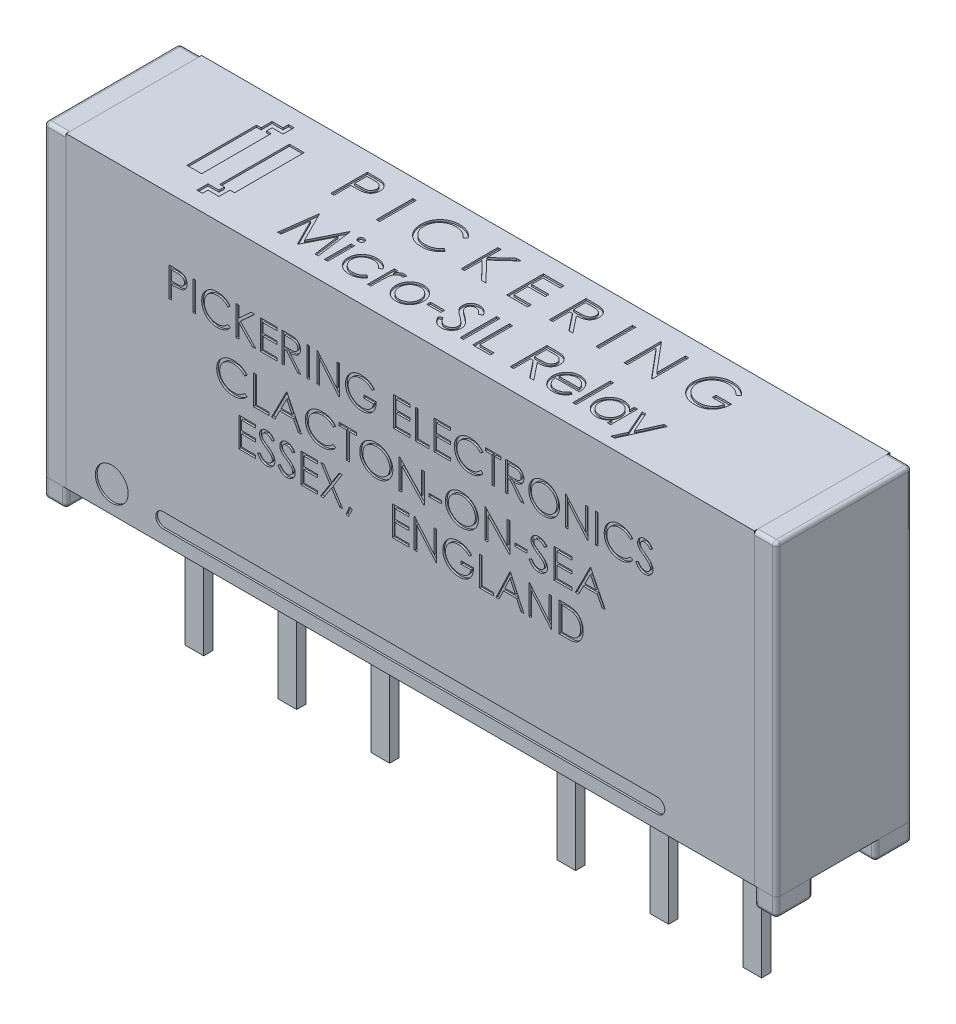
SolidWorks part; units mm, degrees
ref_plane "Front Plane" through (0, 0, 0) normal (0, 0, 1) x (1, 0, 0)
ref_plane "Top Plane" through (0, 0, 0) normal (0, 1, 0) x (1, 0, 0)
ref_plane "Right Plane" through (0, 0, 0) normal (1, 0, 0) x (0, 0, -1)
sketch "Sketch1" plane through (0, 0, 0) normal (0, 1, 0) x (1, 0, 0)
  line L1 (9.4, -1.85) -> (-9.4, -1.85)
  line L2 (9.4, -1.85) -> (9.4, 1.85)
  line L3 (9.4, 1.85) -> (-9.4, 1.85)
  line L4 (-9.4, -1.85) -> (-9.4, 1.85)
  line L5 (9.4, -1.85) -> (-9.4, 1.85) construction
  line L6 (9.4, 1.85) -> (-9.4, -1.85) construction
  point P0 (0, 0)
  dimension "D1" = 3.7
  dimension "D2" = 18.8
extrude "Main Body" add sketch "Sketch1" along normal blind 8.392
sketch "Sketch2" plane through (-9.4, 0, 0) normal (-1, 0, 0) x (0, 0, 1)
  line L1 (-1.85, 8.392) -> (1.85, 8.392)
  line L2 (-1.85, 8.392) -> (-1.85, 0)
  line L3 (-1.85, 0) -> (1.85, 0)
  line L4 (1.85, 8.392) -> (1.85, 0)
extrude "Left Side" add sketch "Sketch2" along normal blind 0.6 separate body
sketch "Sketch3" plane through (9.4, 0, 0) normal (1, 0, 0) x (0, 0, -1)
  line L1 (-1.85, 8.392) -> (1.85, 8.392)
  line L2 (-1.85, 8.392) -> (-1.85, 0)
  line L3 (-1.85, 0) -> (1.85, 0)
  line L4 (1.85, 8.392) -> (1.85, 0)
extrude "Right Side" add sketch "Sketch3" along normal blind 0.6 separate body
sketch "Sketch4" plane through (0, 0, 0) normal (0, -1, 0) x (1, 0, 0)
  line L0 (-9.4, -1.85) -> (-9.4, 1.85) construction
  line L1 (-10, 1.85) -> (-9.4, 1.85)
  line L2 (-10, 1.85) -> (-10, 0.85)
  line L3 (-10, 0.85) -> (-9.4, 0.85)
  line L4 (-9.4, 1.85) -> (-9.4, 0.85)
  line L5 (-9.4, -1.85) -> (-9.4, 1.85) construction
  line L6 (-10, -1.85) -> (-9.4, -1.85)
  line L7 (-10, -1.85) -> (-10, -0.85)
  line L8 (-10, -0.85) -> (-9.4, -0.85)
  line L9 (-9.4, -1.85) -> (-9.4, -0.85)
  line L10 (9.4, 1.85) -> (9.4, -1.85) construction
  line L11 (10, 1.85) -> (9.4, 1.85)
  line L12 (10, 1.85) -> (10, 0.85)
  line L13 (10, 0.85) -> (9.4, 0.85)
  line L14 (9.4, 1.85) -> (9.4, 0.85)
  line L15 (9.4, 1.85) -> (9.4, -1.85) construction
  line L16 (10, -1.85) -> (9.4, -1.85)
  line L17 (10, -1.85) -> (10, -0.85)
  line L18 (10, -0.85) -> (9.4, -0.85)
  line L19 (9.4, -1.85) -> (9.4, -0.85)
  dimension "D1" = 1
  dimension "D2" = 1
  dimension "D3" = 1
  dimension "D4" = 1
extrude "Feet" add sketch "Sketch4" along normal blind 0.508 separate body
sketch "Sketch5" plane through (0, 0, 0) normal (0, -1, 0) x (1, 0, 0)
  line L0 (10, 1.85) -> (10, -1.85) construction
  line L1 (-7.874, -0.127) -> (-7.366, -0.127)
  line L2 (-7.874, -0.127) -> (-7.874, 0.127)
  line L3 (-7.874, 0.127) -> (-7.366, 0.127)
  line L4 (-7.366, -0.127) -> (-7.366, 0.127)
  line L5 (-7.874, -0.127) -> (-7.366, 0.127) construction
  line L6 (-7.874, 0.127) -> (-7.366, -0.127) construction
  line L7 (-2.286, -0.127) -> (-2.794, -0.127)
  line L8 (-2.286, -0.127) -> (-2.286, 0.127)
  line L9 (-2.286, 0.127) -> (-2.794, 0.127)
  line L10 (-2.794, -0.127) -> (-2.794, 0.127)
  line L11 (-2.286, -0.127) -> (-2.794, 0.127) construction
  line L12 (-2.286, 0.127) -> (-2.794, -0.127) construction
  line L13 (2.794, -0.127) -> (2.286, -0.127)
  line L14 (2.794, -0.127) -> (2.794, 0.127)
  line L15 (2.794, 0.127) -> (2.286, 0.127)
  line L16 (2.286, -0.127) -> (2.286, 0.127)
  line L17 (2.794, -0.127) -> (2.286, 0.127) construction
  line L18 (2.794, 0.127) -> (2.286, -0.127) construction
  line L19 (7.366, -0.127) -> (7.874, -0.127)
  line L20 (7.366, -0.127) -> (7.366, 0.127)
  line L21 (7.366, 0.127) -> (7.874, 0.127)
  line L22 (7.874, -0.127) -> (7.874, 0.127)
  line L23 (7.366, -0.127) -> (7.874, 0.127) construction
  line L24 (7.366, 0.127) -> (7.874, -0.127) construction
  line L27 (-4.826, -0.127) -> (-5.334, -0.127)
  line L28 (-4.826, -0.127) -> (-4.826, 0.127)
  line L29 (-4.826, 0.127) -> (-5.334, 0.127)
  line L30 (-5.334, -0.127) -> (-5.334, 0.127)
  line L31 (-4.826, -0.127) -> (-5.334, 0.127) construction
  line L32 (-4.826, 0.127) -> (-5.334, -0.127) construction
  line L33 (4.826, -0.127) -> (5.334, -0.127)
  line L34 (4.826, -0.127) -> (4.826, 0.127)
  line L35 (4.826, 0.127) -> (5.334, 0.127)
  line L36 (5.334, -0.127) -> (5.334, 0.127)
  line L37 (4.826, -0.127) -> (5.334, 0.127) construction
  line L38 (4.826, 0.127) -> (5.334, -0.127) construction
  point P0 (-7.62, 0)
  point P5 (-2.54, 0)
  point P10 (2.54, 0)
  point P15 (7.62, 0)
  point P23 (-5.08, 0)
  point P28 (5.08, 0)
  dimension "D1" = 0.508
  dimension "D2" = 0.254
  dimension "D3" = 0.508
  dimension "D4" = 0.254
  dimension "D5" = 0.508
  dimension "D6" = 0.254
  dimension "D7" = 0.508
  dimension "D8" = 0.254
  dimension "D9" = 5.08
  dimension "D10" = 5.08
  dimension "D11" = 5.08
  dimension "D12" = 2.38
  dimension "D13" = 0.508
  dimension "D14" = 0.254
  dimension "D15" = 2.54
  dimension "D16" = 0.508
  dimension "D17" = 0.254
  dimension "D18" = 2.54
extrude "Pins" add sketch "Sketch5" along normal blind 3.808
sketch "Sketch6"
  dimension "D1" = 10.5
  dimension "D2" = 10.5
  dimension "D3" = 4
  dimension "D4" = 0.45
  dimension "D5" = 3
  dimension "D6" = 1.5
sketch_block_instance "Logo-1"
sketch_block "Logo" parameters "D1"=0.4, "D2"=0.4, "D3"=1.9, "D4"=1.9, "D5"=1.3, "D6"=0.3, "D7"=0.15, "D8"=0.15, "D9"=0.15, "D10"=0.15, "D11"=0.3, "D12"=0.125, "D13"=0.15, "D14"=0.125, "D15"=0.3, "D16"=0.15, "D17"=0.3, "D18"=0.15, "D19"=0.15
extrude "Top side" cut sketch "Sketch6" against normal blind 0.05
sketch "Sketch7"
  dimension "D10" = 0.8963
  dimension "D1" = 13.5
  dimension "D2" = 11
  dimension "D3" = 9.6
  dimension "D4" = 3.25
  dimension "D5" = 4.5
  dimension "D6" = 5.2
  dimension "D7" = 2.5
  dimension "D8" = 1.4
  dimension "D9" = 1.2
extrude "Front Lettering" cut sketch "Sketch7" against normal blind 0.05
sketch "Sketch8"
  dimension "D1" = 11.65
  dimension "D2" = 4.175
  dimension "D3" = 3.5
extrude "Part number" add sketch "Sketch8" along normal blind 0.0001
sketch "Sketch9" plane through (0, 0, -1.85) normal (0, 0, -1) x (-1, 0, 0)
  line L0 (-5.5254, 0.8409) -> (5.9665, 0.8409) construction
  line L1 (-5.5254, 0.9836) -> (5.9665, 0.9836)
  line L2 (-5.5254, 0.6982) -> (5.9665, 0.6982)
  arc A0 (-5.5254, 0.9836) -> (-5.5254, 0.6982) centre (-5.5254, 0.8409) ccw
  arc A1 (5.9665, 0.6982) -> (5.9665, 0.9836) centre (5.9665, 0.8409) ccw
  point P2 (0.2205, 0.8409)
extrude "Extrude9" cut sketch "Sketch9" against normal blind 0.0001
fillet "Fillet1" radius 0.1 5 edges at (10, 4.196, -1.85) (9.7, 8.392, -1.85) (10, 8.392, 0) (9.7, 8.392, 1.85) (10, 4.196, 1.85)
fillet "Fillet2" radius 0.1 5 edges at (-9.7, 8.392, 1.85) (-10, 4.196, 1.85) (-10, 4.196, -1.85) (-9.7, 8.392, -1.85) (-10, 8.392, 0)
fillet "Fillet3" radius 0.1 8 edges at (-9.7, -0.508, 1.85) (-9.4, -0.508, 1.35) (-9.7, -0.508, 0.85) (-10, -0.508, 1.35) (-9.4, -0.254, 1.85) (-9.4, -0.254, 0.85) (-10, -0.254, 0.85) (-10, -0.254, 1.85)
fillet "Fillet4" radius 0.1 8 edges at (-9.7, -0.508, -0.85) (-9.4, -0.508, -1.35) (-9.7, -0.508, -1.85) (-10, -0.508, -1.35) (-10, -0.254, -1.85) (-9.4, -0.254, -1.85) (-9.4, -0.254, -0.85) (-10, -0.254, -0.85)
fillet "Fillet5" radius 0.1 8 edges at (9.7, -0.508, -1.85) (9.4, -0.508, -1.35) (9.7, -0.508, -0.85) (10, -0.508, -1.35) (9.4, -0.254, -0.85) (10, -0.254, -0.85) (9.4, -0.254, -1.85) (10, -0.254, -1.85)
fillet "Fillet6" radius 0.1 8 edges at (9.7, -0.508, 0.85) (9.4, -0.508, 1.35) (9.7, -0.508, 1.85) (10, -0.508, 1.35) (9.4, -0.254, 0.85) (10, -0.254, 0.85) (10, -0.254, 1.85) (9.4, -0.254, 1.85)
